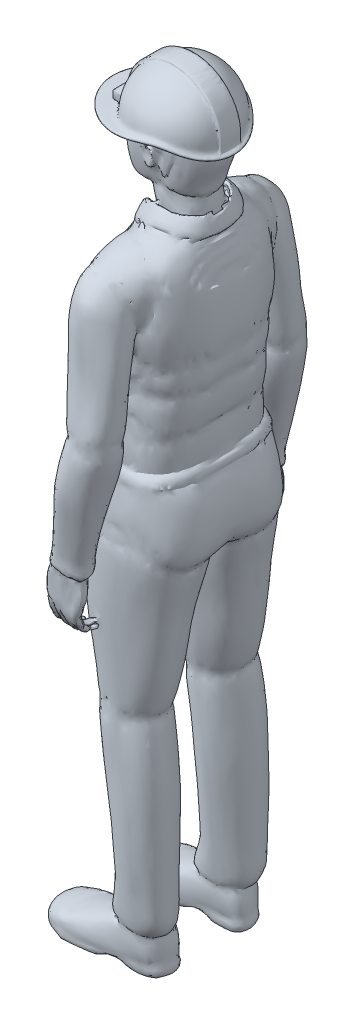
SolidWorks part; units mm, degrees
other "<Hard Hat smaller>-<Imported1>"
ref_plane "Front Plane" through (0, 0, 0) normal (0, 0, 1) x (1, 0, 0)
ref_plane "Top Plane" through (0, 0, 0) normal (0, 1, 0) x (1, 0, 0)
ref_plane "Right Plane" through (0, 0, 0) normal (1, 0, 0) x (0, 0, -1)
imported_body "Imported1"
inserted part "Hard Hat smaller"
move or copy body "Body-Move/Copy2"
move or copy body "Body-Move/Copy3" bodies to move or copy 103 copy no translate (0, 0, 159.8187)
move or copy body "Body-Move/Copy4" bodies to move or copy 104 copy no translate (30.4167, 0, 0)
move or copy body "Body-Move/Copy5" bodies to move or copy 105 copy no translate (9.7123, 0, 0)
